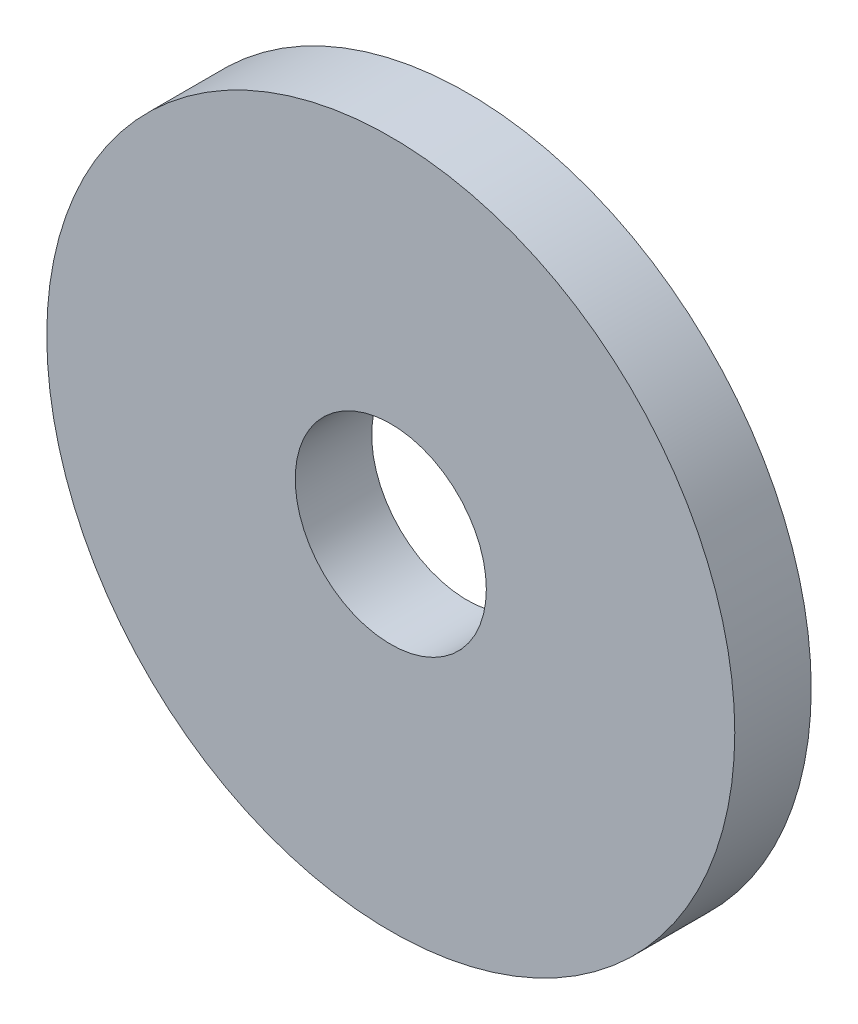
SolidWorks part; units mm, degrees
ref_plane "Front" through (0, 0, 0) normal (0, 0, 1) x (1, 0, 0)
ref_plane "Top" through (0, 0, 0) normal (0, 1, 0) x (1, 0, 0)
ref_plane "Right" through (0, 0, 0) normal (1, 0, 0) x (0, 0, -1)
other "Configuration Table"
sketch "Sketch1" plane through (0, 0, 0) normal (0, 0, 1) x (1, 0, 0)
  circle A0 centre (0, 0) radius 2.5
  circle A1 centre (0, 0) radius 9
  dimension "d1" = 5
  dimension "d2" = 18
extrude "Base-Extrude" add sketch "Sketch1" against normal blind 2
